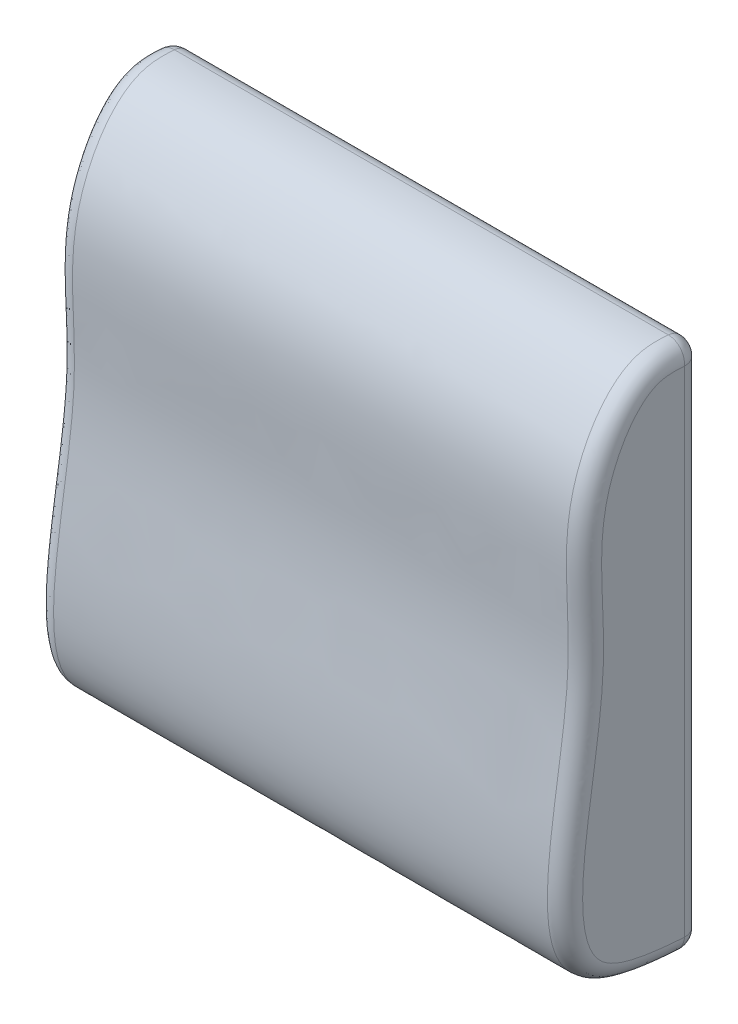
SolidWorks part; units mm, degrees
ref_plane "Plan de face" through (0, 0, 0) normal (0, 0, 1) x (1, 0, 0)
ref_plane "Plan de dessus" through (0, 0, 0) normal (0, 1, 0) x (1, 0, 0)
ref_plane "Plan de droite" through (0, 0, 0) normal (1, 0, 0) x (0, 0, -1)
sketch "Esquisse1" plane through (0, 0, 0) normal (1, 0, 0) x (0, 0, -1)
  line L0 (0, 300) -> (0, 0)
  spline S0 degree 3 poles (0, 0) (-23.3056, 1.3908) (-104.3868, 6.2292) (-52.712, 154.2213) (-75.9632, 244.8663) (-36.1909, 304.4966) (-9.101, 301.1308) (0, 300) knots 0 0 0 0 0.158274 0.550641 0.79887 0.932429 1 1 1 1
  dimension "D1" = 300
extrude "Extrusion1" add sketch "Esquisse1" along normal blind 300
fillet "Congé1" radius 10 6 edges at (150, 300, 0) (150, 0, 0) (300, 150, 0) (0, 150, 0)
sketch "Esquisse2" plane through (0, 0, 0) normal (0, 0, -1) x (-1, 0, 0)
  line L0 (0, 291.0486) -> (0, 10.6451) construction
  line L1 (-220, 190.6451) -> (-180, 190.6451)
  line L2 (-220, 190.6451) -> (-220, 70.6451)
  line L3 (-220, 70.6451) -> (-180, 70.6451)
  line L4 (-180, 190.6451) -> (-180, 70.6451)
  line L5 (-120, 190.6451) -> (-80, 190.6451)
  line L6 (-120, 190.6451) -> (-120, 70.6451)
  line L7 (-120, 70.6451) -> (-80, 70.6451)
  line L8 (-80, 190.6451) -> (-80, 70.6451)
  line L10 (-300, 10.6451) -> (-300, 291.0486) construction
  line L11 (-290, 0.6451) -> (-10, 0.6451) construction
  dimension "D1" = 40
  dimension "D2" = 40
  dimension "D3" = 80
  dimension "D4" = 80
  dimension "D5" = 70
  dimension "D6" = 120
extrude "Extrusion2" add sketch "Esquisse2" along normal blind 2
sketch "Esquisse3" plane through (0, 0, -2) normal (0, 0, -1) x (-1, 0, 0)
  line L0 (-220, 70.6451) -> (-180, 70.6451) construction
  line L1 (-180, 190.6451) -> (-182, 190.6451)
  line L2 (-180, 190.6451) -> (-180, 70.6451)
  line L3 (-180, 70.6451) -> (-182, 70.6451)
  line L4 (-182, 190.6451) -> (-182, 70.6451)
  line L5 (-120, 190.6451) -> (-120, 70.6451) construction
  line L6 (-120, 70.6451) -> (-118, 70.6451)
  line L7 (-120, 70.6451) -> (-120, 190.6451)
  line L8 (-120, 190.6451) -> (-118, 190.6451)
  line L9 (-118, 70.6451) -> (-118, 190.6451)
  line L10 (-120, 190.6451) -> (-120, 70.6451) construction
  line L11 (-80, 190.6451) -> (-120, 190.6451) construction
  dimension "D1" = 2
  dimension "D2" = 2
extrude "Extrusion3" add sketch "Esquisse3" along normal blind 23
sketch "Esquisse4" plane through (0, 0, -25) normal (0, 0, -1) x (-1, 0, 0)
  line L1 (-182, 190.6451) -> (-118, 190.6451)
  line L2 (-182, 190.6451) -> (-182, 70.6451)
  line L3 (-182, 70.6451) -> (-118, 70.6451)
  line L4 (-118, 190.6451) -> (-118, 70.6451)
extrude "Extrusion4" add sketch "Esquisse4" along normal blind 2
fillet "Congé2" radius 2 4 edges
fillet "Congé3" radius 4 2 edges at (118, 130.6451, -27) (182, 130.6451, -27)
